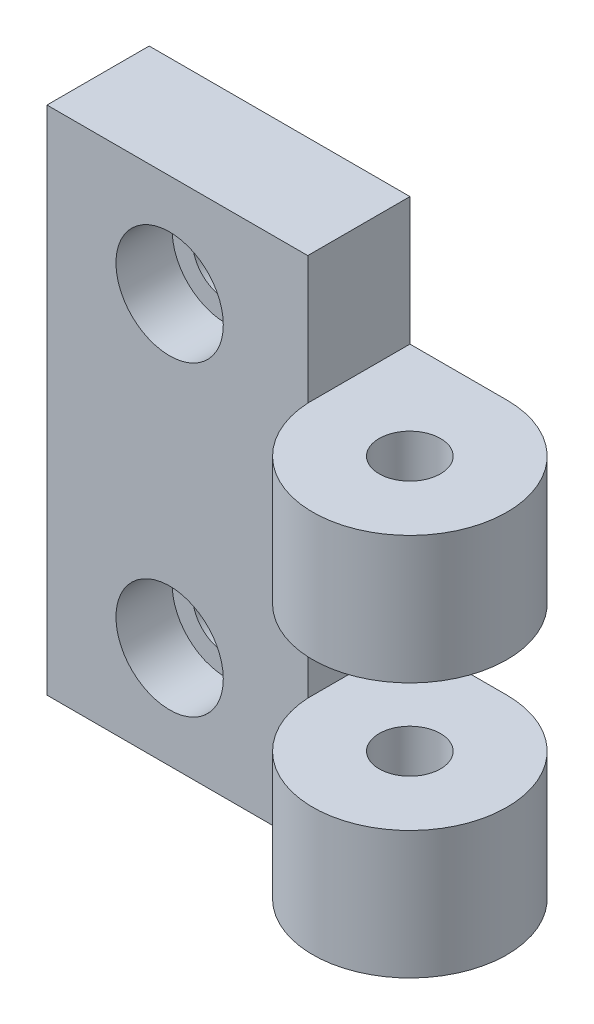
SolidWorks part; units mm, degrees
ref_plane "Plan de face" through (0, 0, 0) normal (0, 0, 1) x (1, 0, 0)
ref_plane "Plan de dessus" through (0, 0, 0) normal (0, 1, 0) x (1, 0, 0)
ref_plane "Plan de droite" through (0, 0, 0) normal (1, 0, 0) x (0, 0, -1)
sketch "Esquisse1" plane through (0, 0, 0) normal (0, 1, 0) x (1, 0, 0)
  line L0 (0, 0) -> (25.5132, 0)
  line L4 (0, 0) -> (0, 10)
  line L16 (0, 10) -> (35, 10)
  circle A0 centre (35, 0.5) radius 3
  arc A1 (25.5132, 0) -> (35, 10) centre (35, 0.5) ccw
  dimension "D1" = 9.5
  dimension "D2" = 10
  dimension "D4" = 6
  dimension "D3" = 35
extrude "Extrusion1" add sketch "Esquisse1" along normal blind 50
sketch "Esquisse2" plane through (0, 0, 0) normal (0, 0, 1) x (1, 0, 0)
  line L0 (44.5, 0) -> (44.5, 50) construction
  line L1 (44.5, 50) -> (25.5132, 50)
  line L2 (44.5, 50) -> (44.5, 37.5)
  line L3 (44.5, 37.5) -> (25.5132, 37.5)
  line L4 (25.5132, 50) -> (25.5132, 37.5)
  line L5 (44.5, 25) -> (25.5132, 25)
  line L6 (44.5, 25) -> (44.5, 12.5)
  line L7 (44.5, 12.5) -> (25.5132, 12.5)
  line L8 (25.5132, 25) -> (25.5132, 12.5)
  line L9 (25.5132, 0) -> (44.5, 0) construction
  line L10 (0, 50) -> (25.5132, 50) construction
  line L11 (25.5132, 50) -> (25.5132, 0) construction
  dimension "D1" = 12.5
  dimension "D2" = 12.5
  dimension "D3" = 12.5
  dimension "D4" = 12.5
extrude "Enlèv. mat.-Extru.1" cut sketch "Esquisse2" against normal mid plane 50
hole_wizard "Chambrage pour vis à tête hexagonale M61" positions "Esquisse4" profile "Esquisse3" counterbore size "M6" standard "ISO"
sketch "Esquisse4" plane through (0, 0, 0) normal (0, 0, 1) x (1, 0, 0)
  line L0 (0, 50) -> (0, 0) construction
  line L1 (0, 50) -> (25.5132, 50) construction
  point P0 (12, 40)
  point P1 (12, 10)
  dimension "D1" = 12
  dimension "D2" = 10
  dimension "D3" = 30
sketch "Esquisse3" plane through (12, 40, 0) normal (1, 0, 0) x (0, -1, 0)
  line L0 (0, 0) -> (0, 10)
  line L1 (0, 10) -> (3.25, 10)
  line L3 (3.25, 10) -> (3.25, 5.5)
  line L4 (3.25, 5.5) -> (5.25, 5.5)
  line L5 (5.25, 5.5) -> (5.25, 0)
  line L7 (5.25, 0) -> (0, 0)
  line L11 (0, -6.35) -> (0, 107.95) construction
  dimension "Diamètre du perçage jusqu'au prochain" = 6.5
  dimension "Profondeur du perçage jusqu'au prochain" = 10
  dimension "Diamètre du chambrage" = 10.5
  dimension "Profondeur du chambrage" = 5.5
